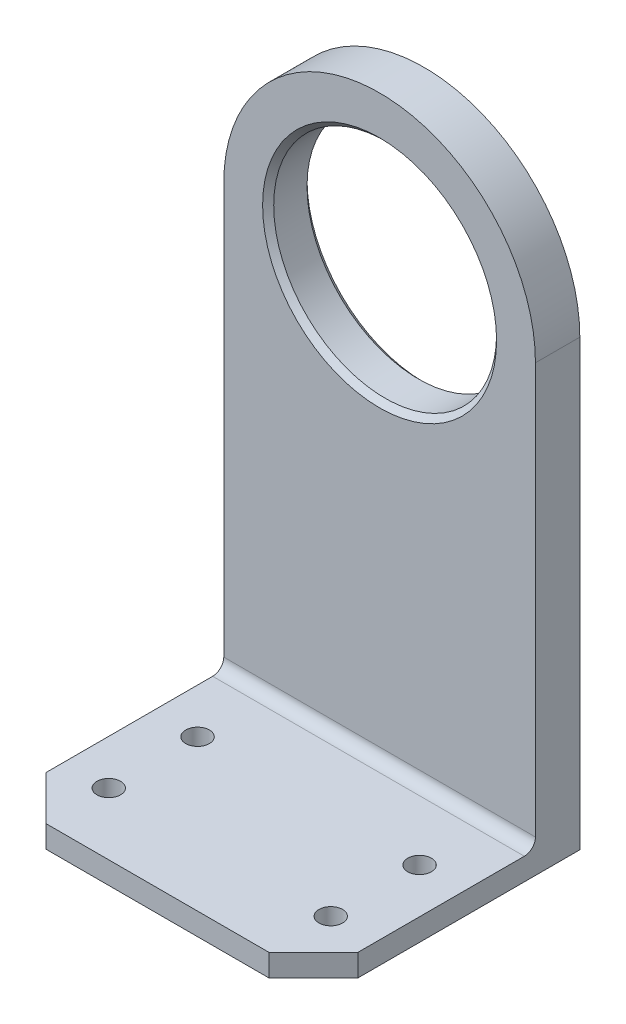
SolidWorks part; units mm, degrees
ref_plane "Front Plane" through (0, 0, 0) normal (0, 0, 1) x (1, 0, 0)
ref_plane "Top Plane" through (0, 0, 0) normal (0, 1, 0) x (1, 0, 0)
ref_plane "Right Plane" through (0, 0, 0) normal (1, 0, 0) x (0, 0, -1)
sketch "Sketch1" plane through (0, 0, 0) normal (0, 0, 1) x (1, 0, 0)
  line L0 (44.575, 0) -> (44.575, -127)
  line L1 (44.575, -127) -> (-44.575, -127)
  line L2 (-44.575, 0) -> (-44.575, -127)
  circle A0 centre (0, 0) radius 31.875
  arc A1 (44.575, 0) -> (-44.575, 0) centre (0, 0) ccw
  circle A2 centre (0, 0) radius 44.575 construction
  dimension "D1" = 63.75
  dimension "D3" = 127
  dimension "D2" = 12.7
extrude "Extrude1" add sketch "Sketch1" along normal blind 12.7
sketch "Sketch2" plane through (0, 0, 12.7) normal (0, 0, 1) x (1, 0, 0)
  line L0 (-44.575, -127) -> (44.575, -127) construction
  line L1 (-44.575, -127) -> (44.575, -127)
  line L2 (-44.575, -120.65) -> (44.575, -120.65)
  line L3 (44.575, -127) -> (44.575, 0) construction
  line L4 (44.575, -127) -> (44.575, -120.65)
  line L5 (-44.575, 0) -> (-44.575, -127) construction
  line L6 (-44.575, -120.65) -> (-44.575, -127)
  dimension "D1" = 6.35
extrude "Extrude2" add sketch "Sketch2" along normal blind 63.5
sketch "Sketch3" plane through (0, -120.65, 0) normal (0, 1, 0) x (1, 0, 0)
  line L0 (0, -76.2) -> (0, 0) construction
  line L1 (44.575, -76.2) -> (-44.575, -76.2) construction
  circle A0 centre (-31.75, -33.02) radius 3.3858
  circle A1 centre (-31.75, -58.42) radius 3.3782
  circle A2 centre (31.75, -33.02) radius 3.3858
  circle A3 centre (31.75, -58.42) radius 3.3782
  dimension "D1" = 6.7716
  dimension "D2" = 63.5
  dimension "D3" = 63.5
  dimension "D4" = 25.4
  dimension "D6" = 6.7564
  dimension "D5" = 17.78
extrude "Cut-Extrude1" cut sketch "Sketch3" against normal through all
fillet "Fillet1" radius 3.175 1 edges
chamfer "Chamfer1" distance 12.7 angle 45 2 edges at (44.575, -123.825, 76.2) (-44.575, -123.825, 76.2)
chamfer "Chamfer2" distance 1.5875 angle 45 2 edges at (31.875, 0, 12.7) (31.875, 0, 0)
